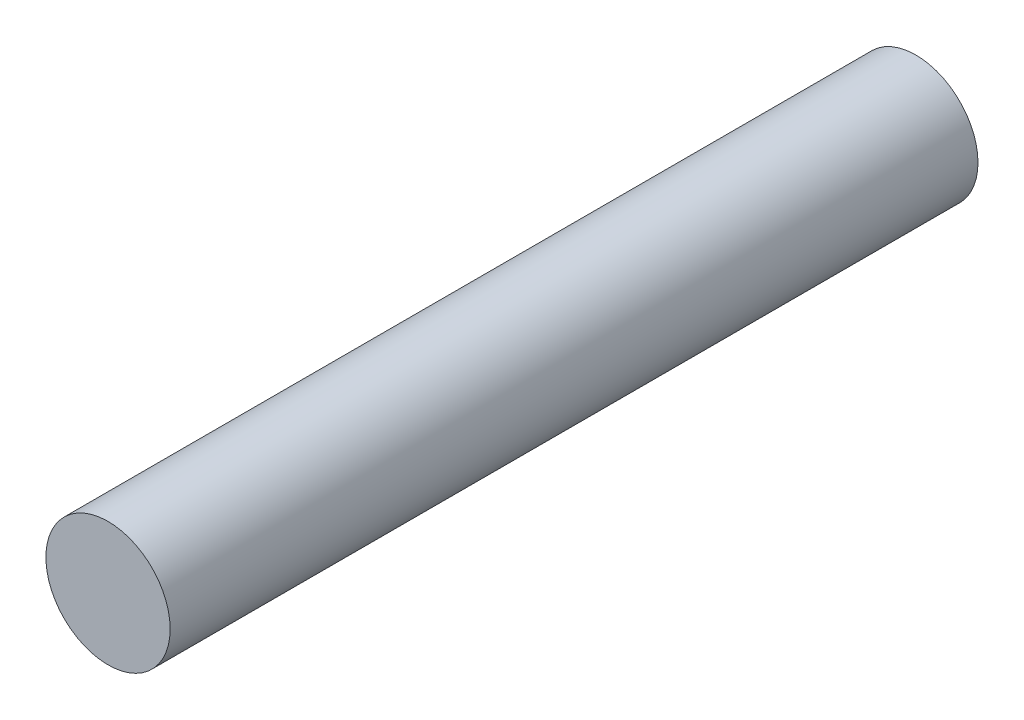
SolidWorks part; units mm, degrees
ref_plane "Face" through (0, 0, 0) normal (0, 0, 1) x (1, 0, 0)
ref_plane "Dessus" through (0, 0, 0) normal (0, 1, 0) x (1, 0, 0)
ref_plane "Droite" through (0, 0, 0) normal (1, 0, 0) x (0, 0, -1)
sketch "Esquisse1" plane through (0, 0, 0) normal (0, 0, 1) x (1, 0, 0)
  circle A0 centre (0, 0) radius 0.5
  dimension "D1" = 1
extrude "Extrusion1" add sketch "Esquisse1" along normal blind 6.5
